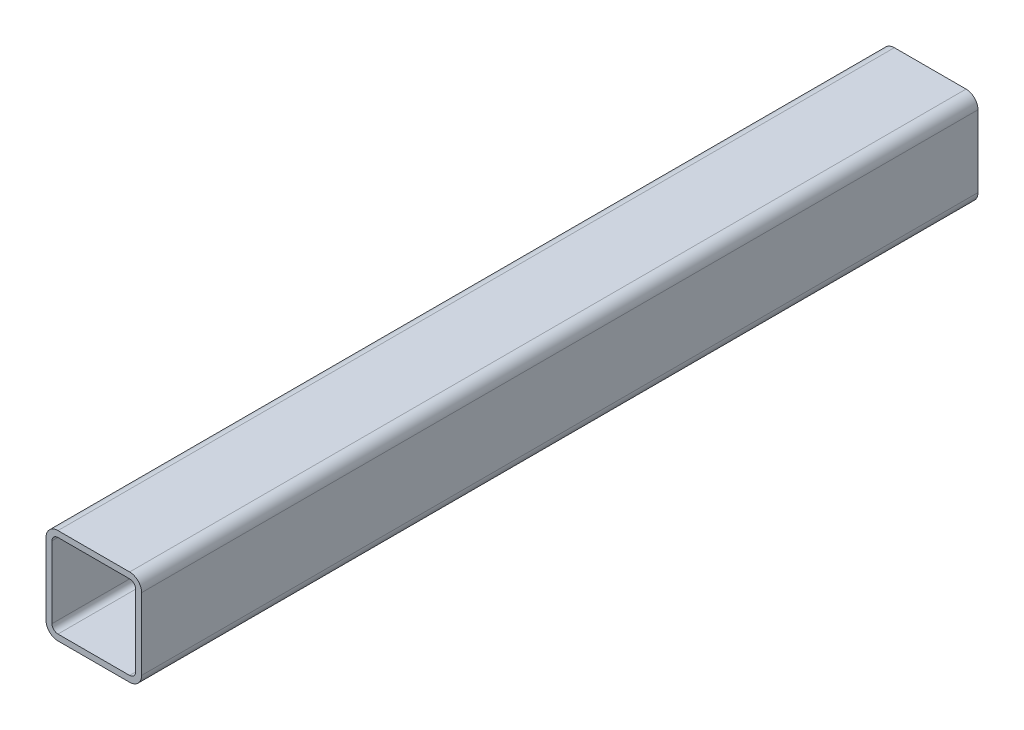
SolidWorks part; units mm, degrees
ref_plane "Front Plane" through (0, 0, 0) normal (1, 0, 0) x (0, 1, 0)
ref_plane "Top Plane" through (0, 0, 0) normal (0, 0, 1) x (0, 1, 0)
ref_plane "Right Plane" through (0, 0, 0) normal (0, 1, 0) x (-1, 0, 0)
sketch "8in beam" plane through (0, 0, 0) normal (0, 0, 1) x (0, 1, 0)
  line B0 (-76.2, -88.9) -> (76.2, -88.9)
  line B1 (-88.9, -76.2) -> (-88.9, 76.2)
  line B2 (76.2, 88.9) -> (-76.2, 88.9)
  line B3 (88.9, 76.2) -> (88.9, -76.2)
  line B4 (-76.2, -101.6) -> (76.2, -101.6)
  line B5 (-101.6, -76.2) -> (-101.6, 76.2)
  line B6 (76.2, 101.6) -> (-76.2, 101.6)
  line B7 (101.6, 76.2) -> (101.6, -76.2)
  arc B8 (101.6, 76.2) -> (76.2, 101.6) centre (76.2, 76.2) ccw
  arc B9 (76.2, -101.6) -> (101.6, -76.2) centre (76.2, -76.2) ccw
  arc B10 (-101.6, -76.2) -> (-76.2, -101.6) centre (-76.2, -76.2) ccw
  arc B11 (-76.2, 101.6) -> (-101.6, 76.2) centre (-76.2, 76.2) ccw
  arc B12 (-76.2, 88.9) -> (-88.9, 76.2) centre (-76.2, 76.2) ccw
  arc B13 (88.9, 76.2) -> (76.2, 88.9) centre (76.2, 76.2) ccw
  arc B14 (76.2, -88.9) -> (88.9, -76.2) centre (76.2, -76.2) ccw
  arc B15 (-88.9, -76.2) -> (-76.2, -88.9) centre (-76.2, -76.2) ccw
sketch_block_instance "8x8x0.5-1"
sketch_block "8x8x0.5" parameters "D1"=25.4, "D2"=12.7, "D3"=12.7, "D4"=12.7, "D5"=203.2, "D6"=203.2, "D7"=177.8, "D8"=177.8
extrude "Beam 6in" add sketch "8in beam" along normal blind 152.4 and the other way blind 1625.6
sketch "sk cross" plane through (0, 0, 0) normal (0, 0, 1) x (0, -1, 0)
  line L0 (111.25, 27.815) -> (-111.25, -27.815) construction
  point P2 (0, 0)
  line B0 (111.25, 27.815) -> (111.25, -27.815)
  line B1 (111.25, -27.815) -> (-111.25, -27.815)
  line B2 (-111.25, -27.815) -> (-111.25, 27.815)
  line B3 (-111.25, 27.815) -> (111.25, 27.815)
sketch_block_instance "Cross base sk-1"
sketch_block "Cross base sk"
